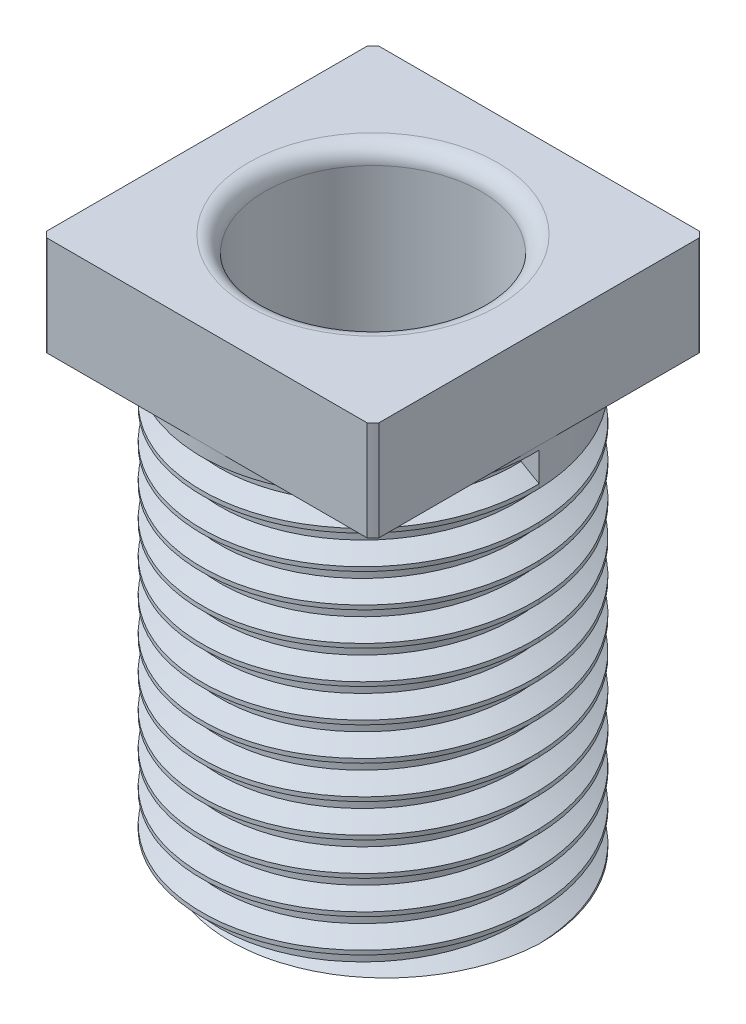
SolidWorks part; units mm, degrees
ref_plane "Płaszczyzna przednia" through (0, 0, 0) normal (0, 0, 1) x (1, 0, 0)
ref_plane "Płaszczyzna górna" through (0, 0, 0) normal (0, 1, 0) x (1, 0, 0)
ref_plane "Płaszczyzna prawa" through (0, 0, 0) normal (1, 0, 0) x (0, 0, -1)
sketch "Szkic1" plane through (0, 0, 0) normal (0, 1, 0) x (1, 0, 0)
  line L0 (-5.5, 3.5001) -> (-5.5, -3.5001)
  line L1 (-3.5001, -5.5) -> (3.5001, -5.5)
  line L2 (5.5, -3.5001) -> (5.5, 3.5001)
  line L3 (3.5001, 5.5) -> (-3.5001, 5.5)
  line L4 (5.5, 0) -> (-5.5, 0) construction
  circle A0 centre (0, 0) radius 3.25
  ellipse E0 centre (-3.4999, -3.4999) end of major axis (-4.9142, -4.9142) minor radius 2 (-5.5, -3.5001) -> (-3.5001, -5.5) ccw
  ellipse E1 centre (3.4999, -3.4999) end of major axis (2.0856, -2.0856) minor radius 2 (3.5001, -5.5) -> (5.5, -3.5001) ccw
  ellipse E2 centre (3.4999, 3.4999) end of major axis (4.9142, 4.9142) minor radius 2 (5.5, 3.5001) -> (3.5001, 5.5) ccw
  ellipse E3 centre (-3.4999, 3.4999) end of major axis (-4.9142, 4.9142) minor radius 2 (-3.5001, 5.5) -> (-5.5, 3.5001) ccw
  dimension "D1" = 11
  dimension "D2" = 6.5
extrude "Dodanie-wyciągnięcie1" add sketch "Szkic1" along normal blind 3
sketch "Szkic2" plane through (0, 3, 0) normal (0, 1, 0) x (1, 0, 0)
  line L1 (-5, -5) -> (5, -5)
  line L2 (-5, -5) -> (-5, 5)
  line L3 (-5, 5) -> (5, 5)
  line L4 (5, -5) -> (5, 5)
  line L5 (0, 5) -> (0, -5) construction
  line L6 (-5, 0) -> (5, 0) construction
  point P0 (0, 0)
  dimension "D1" = 10
  dimension "D2" = 10
extrude "Wytnij-wyciągnięcie1" cut sketch "Szkic2" against normal blind 3 flip side to cut
sketch "Szkic3" plane through (0, 0, 0) normal (0, -1, 0) x (1, 0, 0)
  circle A0 centre (0, 0) radius 3.25
  circle A1 centre (0, 0) radius 5
  circle A2 centre (0, 0) radius 3.25 construction
  dimension "D1" = 0
extrude "Dodanie-wyciągnięcie2" add sketch "Szkic3" along normal blind 13
thread "Gwint1" pitch 1 start angle 0, offset 1, length 13, pitch 1, diameter 10
ref_plane "Płaszczyzna1" through (5, -14, 0) normal (0, 0, 1) x (1, 0, 0)
sketch "Profil gwintu1" plane through (5, -14, 0) normal (0, 0, 1) x (1, 0, 0)
  line L0 (0, 0) -> (0, 1) construction
  line L11 (0, 0) -> (0, 0.875)
  line L12 (0, 0.875) -> (-0.5413, 0.5625)
  line L13 (-0.5413, 0.5625) -> (-0.5413, 0.3125)
  line L15 (-0.5413, 0.3125) -> (0, 0)
  line L17 (-0.5413, 0.4375) -> (0, 0.4375) construction
  point P2 (0, 0)
  dimension "Pitch" = 1
  dimension "Profile_Angle" = 60
  dimension "Profile_Land" = 0.25
  dimension "Profile_Height" = 0.5413
fillet "Zaokrąglenie1" radius 1 1 edges at (0, -13, -3.25)
fillet "Zaokrąglenie2" radius 0.5 1 edges at (0, 3, 3.25)
